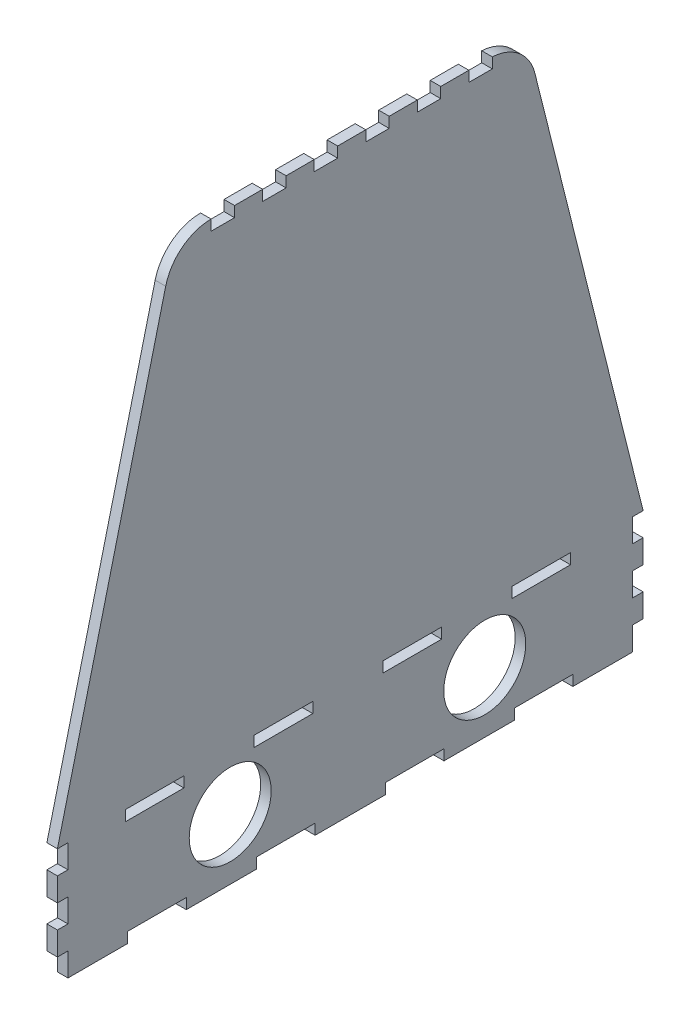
SolidWorks part; units mm, degrees
ref_plane "Front Plane" through (0, 0, 0) normal (0, 0, 1) x (1, 0, 0)
ref_plane "Top Plane" through (0, 0, 0) normal (0, 1, 0) x (1, 0, 0)
ref_plane "Right Plane" through (0, 0, 0) normal (1, 0, 0) x (0, 0, -1)
sketch "Sketch2" plane through (0, 0, 0) normal (1, 0, 0) x (0, 0, -1)
  line L1 (250, -256.4378) -> (157.5746, 113.2637)
  line L2 (118.7689, 143.5622) -> (-118.7689, 143.5622)
  line L3 (-157.5746, 113.2637) -> (-250, -256.4378)
  line L83 (250, -256.4378) -> (250, -356.4378)
  line L84 (250, -356.4378) -> (-250, -356.4378)
  line L85 (-250, -256.4378) -> (-250, -356.4378)
  arc A2 (-118.7689, 143.5622) -> (-157.5746, 113.2637) centre (-118.7689, 103.5622) ccw
  arc A3 (157.5746, 113.2637) -> (118.7689, 143.5622) centre (118.7689, 103.5622) ccw
  point P2 (0, 143.5622)
  point P5 (0, -356.4378)
  point P12 (-150, 143.5622)
  point P17 (150, 143.5622)
  dimension "D4" = 420.9769
  dimension "D3" = 40
  dimension "D1" = 400
  dimension "D2" = 300
  dimension "D5" = 100
  dimension "D11" = 500
extrude "Boss-Extrude1" add sketch "Sketch2" along normal blind 9
sketch "Sketch5" plane through (0, 0, 0) normal (-1, 0, 0) x (0, 0, 1)
  line L0 (250, -356.4378) -> (-250, -356.4378) construction
  line L1 (-190, -356.4378) -> (-140, -356.4378)
  line L2 (-190, -356.4378) -> (-190, -347.4378)
  line L3 (-190, -347.4378) -> (-140, -347.4378)
  line L4 (-140, -356.4378) -> (-140, -347.4378)
  line L5 (-78, -256.4378) -> (-78, -265.4378)
  line L6 (-188, -256.4378) -> (-138, -256.4378)
  line L7 (-188, -256.4378) -> (-188, -265.4378)
  line L8 (-188, -265.4378) -> (-138, -265.4378)
  line L9 (-138, -256.4378) -> (-138, -265.4378)
  line L10 (-78, -256.4378) -> (-28, -256.4378)
  line L11 (-28, -256.4378) -> (-28, -265.4378)
  line L12 (-78, -265.4378) -> (-28, -265.4378)
  line L13 (-80, -356.4378) -> (-80, -347.4378)
  line L14 (-80, -356.4378) -> (-30, -356.4378)
  line L15 (-30, -356.4378) -> (-30, -347.4378)
  line L16 (-80, -347.4378) -> (-30, -347.4378)
  line L17 (32, -256.4378) -> (32, -265.4378)
  line L18 (32, -256.4378) -> (82, -256.4378)
  line L19 (82, -256.4378) -> (82, -265.4378)
  line L20 (32, -265.4378) -> (82, -265.4378)
  line L21 (30, -356.4378) -> (30, -347.4378)
  line L22 (30, -356.4378) -> (80, -356.4378)
  line L23 (80, -356.4378) -> (80, -347.4378)
  line L24 (30, -347.4378) -> (80, -347.4378)
  line L25 (142, -256.4378) -> (142, -265.4378)
  line L26 (142, -256.4378) -> (192, -256.4378)
  line L27 (192, -256.4378) -> (192, -265.4378)
  line L28 (142, -265.4378) -> (192, -265.4378)
  line L29 (140, -356.4378) -> (140, -347.4378)
  line L30 (140, -356.4378) -> (190, -356.4378)
  line L31 (190, -356.4378) -> (190, -347.4378)
  line L32 (140, -347.4378) -> (190, -347.4378)
  line L33 (74.7689, 143.5622) -> (74.7689, 134.5622)
  line L34 (118.7689, 143.5622) -> (98.7689, 143.5622)
  line L35 (118.7689, 143.5622) -> (118.7689, 134.5622)
  line L36 (118.7689, 134.5622) -> (98.7689, 134.5622)
  line L37 (98.7689, 143.5622) -> (98.7689, 134.5622)
  line L38 (74.7689, 143.5622) -> (54.7689, 143.5622)
  line L39 (54.7689, 143.5622) -> (54.7689, 134.5622)
  line L40 (74.7689, 134.5622) -> (54.7689, 134.5622)
  line L41 (30.7689, 143.5622) -> (30.7689, 134.5622)
  line L42 (30.7689, 143.5622) -> (10.7689, 143.5622)
  line L43 (10.7689, 143.5622) -> (10.7689, 134.5622)
  line L44 (30.7689, 134.5622) -> (10.7689, 134.5622)
  line L45 (-13.2311, 143.5622) -> (-13.2311, 134.5622)
  line L46 (-13.2311, 143.5622) -> (-33.2311, 143.5622)
  line L47 (-33.2311, 143.5622) -> (-33.2311, 134.5622)
  line L48 (-13.2311, 134.5622) -> (-33.2311, 134.5622)
  line L49 (-57.2311, 143.5622) -> (-57.2311, 134.5622)
  line L50 (-57.2311, 143.5622) -> (-77.2311, 143.5622)
  line L51 (-77.2311, 143.5622) -> (-77.2311, 134.5622)
  line L52 (-57.2311, 134.5622) -> (-77.2311, 134.5622)
  line L53 (-101.2311, 143.5622) -> (-101.2311, 134.5622)
  line L54 (-101.2311, 143.5622) -> (-121.2311, 143.5622)
  line L55 (-121.2311, 143.5622) -> (-121.2311, 134.5622)
  line L56 (-101.2311, 134.5622) -> (-121.2311, 134.5622)
  circle A0 centre (-114.8075, -304.748) radius 35
  circle A1 centre (102.4836, -304.748) radius 35
  dimension "D8" = 70
  dimension "D1" = 50
  dimension "D2" = 9
  dimension "D3" = 60
  dimension "D4" = 50
  dimension "D5" = 62
  dimension "D7" = 9
  dimension "D9" = 20
  dimension "D10" = 9
  dimension "D11" = 60
  dimension "D6" = 4
extrude "Cut-Extrude2" cut sketch "Sketch5" against normal through all
sketch "Sketch4" plane through (9, 0, 0) normal (1, 0, 0) x (0, 0, -1)
  line L16 (-250, -296.4378) -> (-250, -316.4378)
  line L17 (-250, -256.4378) -> (-241, -256.4378)
  line L18 (-250, -256.4378) -> (-250, -276.4378)
  line L19 (-250, -276.4378) -> (-241, -276.4378)
  line L20 (-241, -256.4378) -> (-241, -276.4378)
  line L21 (-250, -296.4378) -> (-241, -296.4378)
  line L22 (-241, -296.4378) -> (-241, -316.4378)
  line L23 (-250, -316.4378) -> (-241, -316.4378)
  line L24 (-250, -336.4378) -> (-250, -356.4378)
  line L25 (-250, -336.4378) -> (-241, -336.4378)
  line L26 (-241, -336.4378) -> (-241, -356.4378)
  line L27 (-250, -356.4378) -> (-241, -356.4378)
  line L28 (0, 0) -> (0, -410.2917) construction
  line L29 (250, -276.4378) -> (241, -276.4378)
  line L30 (241, -256.4378) -> (241, -276.4378)
  line L31 (250, -256.4378) -> (241, -256.4378)
  line L32 (250, -256.4378) -> (250, -276.4378)
  line L33 (250, -336.4378) -> (241, -336.4378)
  line L34 (241, -336.4378) -> (241, -356.4378)
  line L35 (250, -356.4378) -> (241, -356.4378)
  line L36 (250, -336.4378) -> (250, -356.4378)
  line L37 (250, -296.4378) -> (241, -296.4378)
  line L38 (241, -296.4378) -> (241, -316.4378)
  line L39 (250, -316.4378) -> (241, -316.4378)
  line L40 (250, -296.4378) -> (250, -316.4378)
  dimension "D1" = 20
  dimension "D2" = 9
  dimension "D3" = 3
extrude "Cut-Extrude3" cut sketch "Sketch4" against normal through all
